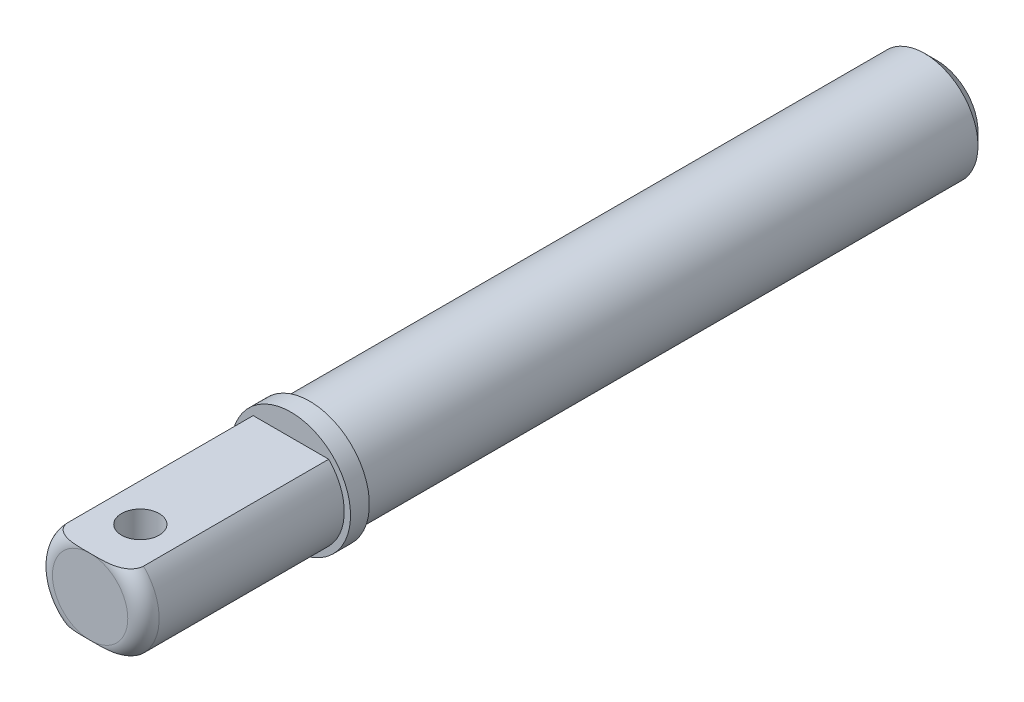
SolidWorks part; units mm, degrees
ref_plane "Plane1" through (0, 0, 0) normal (0, 0, 1) x (1, 0, 0)
ref_plane "Plane2" through (0, 0, 0) normal (0, 1, 0) x (1, 0, 0)
ref_plane "Plane3" through (0, 0, 0) normal (1, 0, 0) x (0, 0, -1)
sketch "Esquisse1" plane through (0, 0, 0) normal (0, 0, 1) x (1, 0, 0)
  circle A0 centre (0, 0) radius 8.5
  dimension "D1" = 17
extrude "Base-Extrusion" add sketch "Esquisse1" along normal blind 135
ref_plane "Plan4" through (0, 0, 100) normal (0, 0, -1) x (-1, 0, 0)
sketch "Esquisse2" plane through (0, 0, 100) normal (0, 0, -1) x (-1, 0, 0)
  circle A0 centre (0, 0) radius 9.5
  dimension "D1" = 19
extrude "Boss.-Extru.1" add sketch "Esquisse2" against normal blind 3
chamfer "Chanfrein1" distance 2 angle 45
ref_plane "Plan5" through (0, 6, 0) normal (0, 1, 0) x (-1, 0, 0)
sketch "Esquisse4" plane through (0, 6, 0) normal (0, 1, 0) x (-1, 0, 0)
  line L0 (-30, 143) -> (40, 143)
  line L1 (-30, 143) -> (-30, 103)
  line L2 (40, 103) -> (-30, 103)
  line L3 (40, 103) -> (40, 143)
  line L4 (-8.5, 135) -> (8.5, 135) construction
  dimension "D1" = 32
extrude "Enlèv. mat.-Extru.1" cut sketch "Esquisse4" along normal blind 6
ref_plane "Plan6" through (0, -6, 0) normal (0, 1, 0) x (-1, 0, 0)
sketch "Esquisse5" plane through (0, -6, 0) normal (0, 1, 0) x (-1, 0, 0)
  line L0 (-19.8035, 135) -> (20.2681, 135)
  line L1 (-19.8035, 135) -> (-19.8035, 103)
  line L2 (20.2681, 103) -> (-19.8035, 103)
  line L3 (20.2681, 103) -> (20.2681, 135)
extrude "Enlèv. mat.-Extru.2" cut sketch "Esquisse5" against normal blind 6
sketch "Esquisse6" plane through (0, 6, 0) normal (0, 1, 0) x (-1, 0, 0)
  line L0 (0, 120) -> (0, 135) construction
  line L1 (0, 185) -> (0, 85) construction
  line L2 (6.0208, 135) -> (-6.0208, 135) construction
  circle A0 centre (0, 127) radius 3
  dimension "D1" = 6
  dimension "D2" = 8
extrude "Enlèv. mat.-Extru.4" cut sketch "Esquisse6" against normal blind 20
fillet "Congé4" radius 2.5
